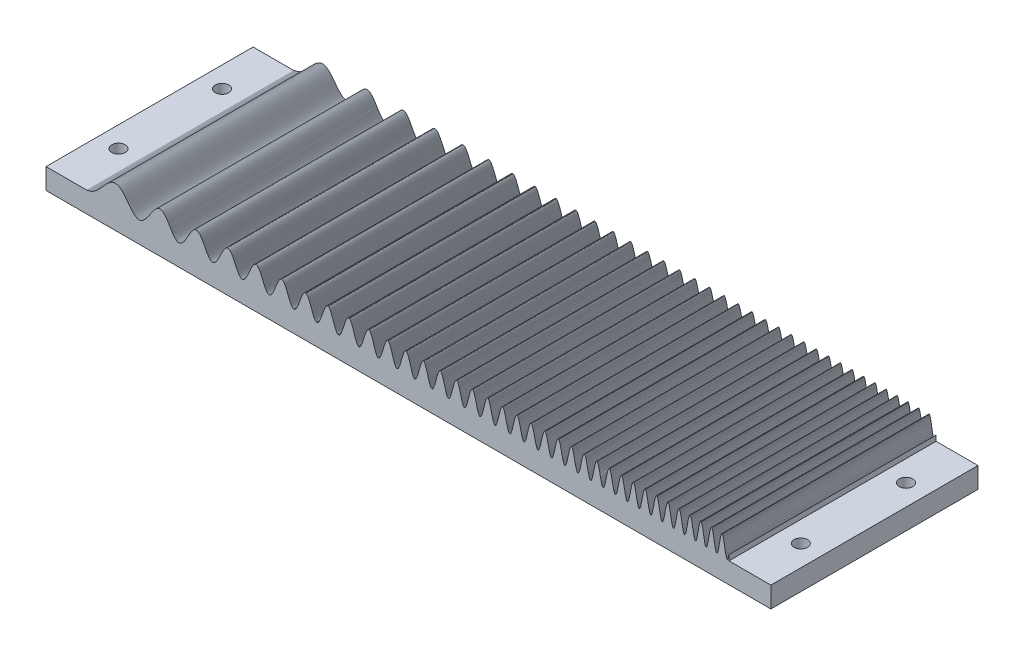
SolidWorks part; units mm, degrees
ref_plane "Front Plane" through (0, 0, 0) normal (0, 0, 1) x (1, 0, 0)
ref_plane "Top Plane" through (0, 0, 0) normal (0, 1, 0) x (1, 0, 0)
ref_plane "Right Plane" through (0, 0, 0) normal (1, 0, 0) x (0, 0, -1)
sketch "Model"
  dimension "D1" = 20
  dimension "D2" = 10
  dimension "D3" = 350
extrude "Boss-Extrude1" add sketch "Model" along normal blind 100
sketch "Sketch2" plane through (0, -10, 0) normal (0, -1, 0) x (1, 0, 0)
  line L0 (-20, 50) -> (330, 50) construction
  line L1 (-20, 100) -> (-20, 0) construction
  line L2 (330, 100) -> (330, 0) construction
  line L3 (154.8817, 100) -> (155, 0) construction
  line L6 (-20, 0) -> (330, 0) construction
  circle A0 centre (-10, 75) radius 3.25
  circle A1 centre (319.822, 75.3903) radius 3.25
  circle A2 centre (319.822, 24.6097) radius 3.25
  circle A3 centre (-10, 25) radius 3.25
  dimension "D1" = 6.5
  dimension "D2" = 25
  dimension "D3" = 10
extrude "Cut-Extrude1" cut sketch "Sketch2" against normal through all
